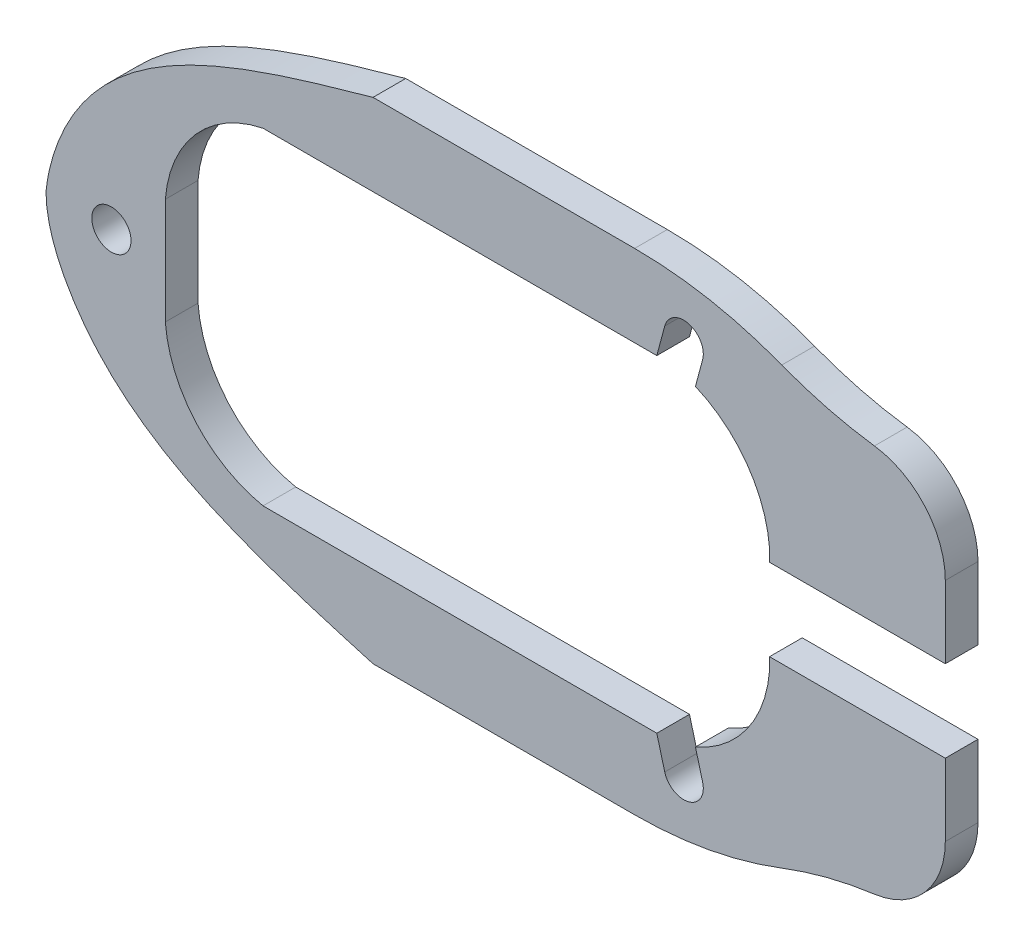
SolidWorks part; units mm, degrees
ref_plane "Face" through (0, 0, 0) normal (0, 0, 1) x (1, 0, 0)
ref_plane "Dessus" through (0, 0, 0) normal (0, 1, 0) x (1, 0, 0)
ref_plane "Droite" through (0, 0, 0) normal (1, 0, 0) x (0, 0, -1)
sketch "Esquisse1" plane through (0, 0, 0) normal (0, 0, 1) x (1, 0, 0)
  line L0 (-174.1176, 41.361) -> (-158.1176, 41.361)
  line L1 (-174.1176, 11.361) -> (-158.1176, 11.361)
  line L4 (-139.1176, 26.361) -> (-241.3155, 26.361) construction
  line L7 (-194.1176, 26.361) -> (-194.1176, 51.1644) construction
  line L13 (-139.1176, 33.2765) -> (-139.1176, 19.4455)
  arc A0 (-143.451, 14.4902) -> (-149.1176, 13.0372) centre (-140.1176, -10.2866) ccw
  arc A1 (-149.1176, 13.0372) -> (-158.1176, 11.361) centre (-158.1176, 36.361) cw
  arc A2 (-149.1176, 39.6848) -> (-158.1176, 41.361) centre (-158.1176, 16.361) ccw
  arc A3 (-143.451, 38.2318) -> (-149.1176, 39.6848) centre (-140.1176, 63.0086) cw
  arc A4 (-139.1176, 19.4455) -> (-143.451, 14.4902) centre (-144.1176, 19.4455) cw
  arc A5 (-143.451, 38.2318) -> (-139.1176, 33.2765) centre (-144.1176, 33.2765) cw
  point P3 (-192.6592, 30.9164)
  point P6 (-139.1176, 14.6934)
  point P11 (-192.6592, 21.8056)
  point P31 (-139.1176, 38.0286)
  dimension "D2" = 5
  dimension "D4" = 5
  dimension "D5" = 55
  dimension "D15" = 25
  dimension "D16" = 25
  dimension "D3" = 15
  dimension "D6" = 16
  dimension "D7" = 9
  dimension "D14" = 20
extrude "Base-Extrusion" add sketch "Esquisse1" along normal blind 2
sketch "Esquisse2" plane through (0, 0, 2) normal (0, 0, 1) x (1, 0, 0)
  line L0 (-149.8676, 29.611) -> (-149.8676, 28.861)
  line L1 (-180.8437, 36.361) -> (-155.8437, 36.361)
  line L2 (-186.8198, 29.611) -> (-186.8198, 23.111)
  line L3 (-180.8437, 16.361) -> (-155.8437, 16.361)
  line L4 (-149.8676, 23.861) -> (-149.8676, 23.111)
  line L5 (-139.1176, 19.4455) -> (-139.1176, 33.2765) construction
  line L6 (-149.8676, 28.861) -> (-139.1176, 28.861)
  line L7 (-194.3634, 26.361) -> (-139.7026, 26.361) construction
  line L9 (-149.8676, 23.861) -> (-139.1176, 23.861)
  line L10 (-139.1176, 28.861) -> (-139.1176, 23.861)
  arc A0 (-155.8437, 36.361) -> (-149.8676, 29.611) centre (-157.3437, 29.0125) cw
  arc A1 (-186.8198, 23.111) -> (-180.8437, 16.361) centre (-179.3437, 23.7095) ccw
  arc A2 (-155.8437, 16.361) -> (-149.8676, 23.111) centre (-157.3437, 23.7095) ccw
  arc A3 (-186.8198, 29.611) -> (-180.8437, 36.361) centre (-179.3437, 29.0125) cw
  point P1 (-149.1176, 26.361)
  point P11 (-186.8198, 26.361)
  dimension "D3" = 1.5
  dimension "D4" = 7.5
  dimension "D1" = 7.5
  dimension "D2" = 1.5
  dimension "D5" = 6.5
  dimension "D6" = 5
  dimension "D7" = 10.75
  dimension "D8" = 25
  dimension "D9" = 10
  dimension "D10" = 2.5
  dimension "D11" = 6.5
extrude "Enlèv. mat.-Extru.1" cut sketch "Esquisse2" against normal through all
sketch "Esquisse7" plane through (0, 0, 0) normal (0, 0, 1) x (1, 0, 0)
  line L0 (-141.6308, 26.361) -> (-194.5061, 26.361) construction
  circle A0 centre (-190.1176, 26.361) radius 1.2
  dimension "D1" = 4
  dimension "D2" = 2.4
extrude "Enlèv. mat.-Extru.4" cut sketch "Esquisse7" along normal through all
sketch "Esquisse8" plane through (0, 0, 0) normal (0, 0, 1) x (1, 0, 0)
  line L0 (-190.4611, 26.361) -> (-146.8594, 26.361) construction
  line L1 (-156.2767, 38.1716) -> (-157.0882, 35.1431)
  line L2 (-157.0882, 35.1431) -> (-154.77, 34.522)
  line L3 (-154.77, 34.522) -> (-153.9585, 37.5504)
  line L4 (-155.8437, 36.361) -> (-180.8437, 36.361) construction
  line L5 (-157.0882, 17.5789) -> (-154.77, 18.2001)
  line L6 (-156.2767, 14.5504) -> (-157.0882, 17.5789)
  line L7 (-154.77, 18.2001) -> (-153.9585, 15.1716)
  arc A0 (-153.9585, 37.5504) -> (-156.2767, 38.1716) centre (-155.1176, 37.861) ccw
  circle A1 centre (-190.1176, 26.361) radius 1.2 construction
  arc A2 (-153.9585, 15.1716) -> (-156.2767, 14.5504) centre (-155.1176, 14.861) cw
  dimension "D1" = 2.4
  dimension "D4" = 11.5
  dimension "D5" = 35
  dimension "D2" = 2.4
  dimension "D3" = 105
  dimension "D6" = 3.1353
extrude "Enlèv. mat.-Extru.5" cut sketch "Esquisse8" along normal through all
